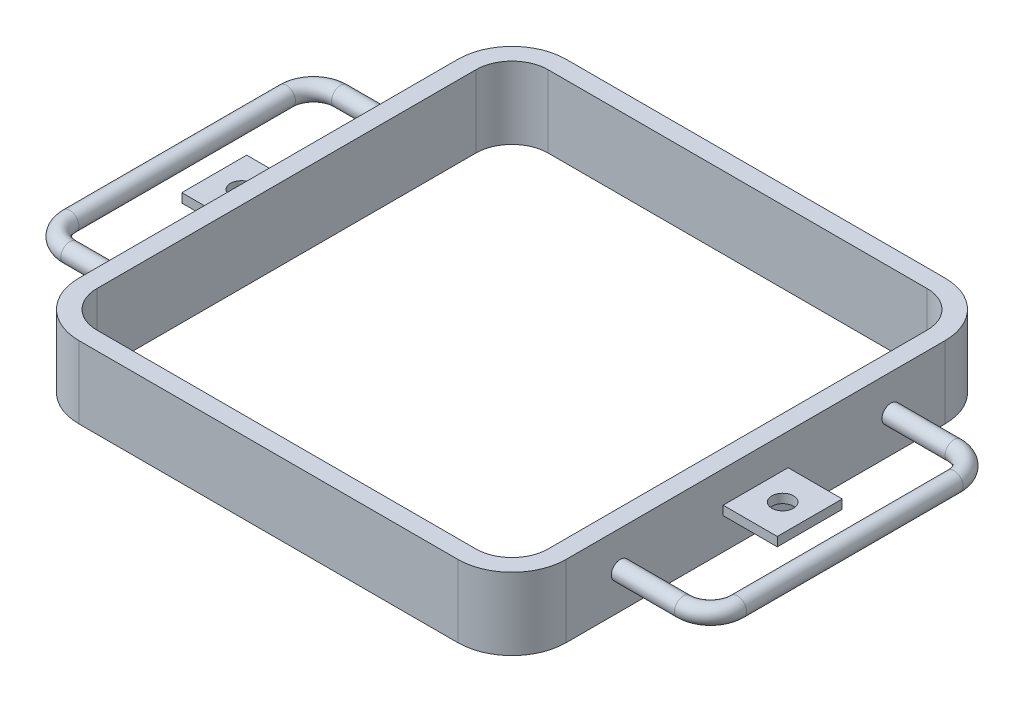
SolidWorks part; units mm, degrees
ref_plane "Front Plane" through (0, 0, 0) normal (0, 0, 1) x (1, 0, 0)
ref_plane "Top Plane" through (0, 0, 0) normal (0, 1, 0) x (1, 0, 0)
ref_plane "Right Plane" through (0, 0, 0) normal (1, 0, 0) x (0, 0, -1)
sketch "Sketch1" plane through (0, 0, 0) normal (0, 1, 0) x (1, 0, 0)
  line L0 (-135, 105) -> (-135, -105)
  line L1 (-105, 125) -> (105, 125)
  line L2 (-125, 105) -> (-125, -105)
  line L3 (-105, -125) -> (105, -125)
  line L4 (125, 105) -> (125, -105)
  line L5 (-125, 125) -> (125, -125) construction
  line L6 (-125, -125) -> (125, 125) construction
  line L7 (-105, -135) -> (105, -135)
  line L8 (135, 105) -> (135, -105)
  line L9 (-105, 135) -> (105, 135)
  arc A0 (105, 125) -> (125, 105) centre (105, 105) cw
  arc A1 (105, -125) -> (125, -105) centre (105, -105) ccw
  arc A2 (-125, -105) -> (-105, -125) centre (-105, -105) ccw
  arc A3 (-105, 125) -> (-125, 105) centre (-105, 105) ccw
  arc A4 (-135, -105) -> (-105, -135) centre (-105, -105) ccw
  arc A5 (105, -135) -> (135, -105) centre (105, -105) ccw
  arc A6 (105, 135) -> (135, 105) centre (105, 105) cw
  arc A7 (-105, 135) -> (-135, 105) centre (-105, 105) ccw
  point P0 (0, 0)
  dimension "D3" = 20
  dimension "D1" = 250
  dimension "D2" = 250
  dimension "D4" = 10
extrude "Boss-Extrude1" add sketch "Sketch1" along normal mid plane 40
sketch "Sketch2" plane through (0, 0, 135) normal (0, 0, 1) x (1, 0, 0)
  line L0 (-105, 15) -> (105, 15) construction
  line L1 (-105, -20) -> (105, -20) construction
  line L2 (-105, 20) -> (-105, -20) construction
  line L4 (105, 20) -> (105, -20) construction
  text T0 "GRAND ASIA" font "Century Gothic" height in points 85
  dimension "D1" = 35
extrude "Boss-Extrude2" [suppressed] add sketch "Sketch2" along normal blind 0.1
sketch "Sketch3" plane through (0, 0, 0) normal (0, 1, 0) x (1, 0, 0)
  line L0 (0, 0) -> (0, 135) construction
  line L1 (105, 135) -> (-105, 135) construction
  line L2 (-135, -75) -> (-170, -75)
  line L4 (-135, 105) -> (-135, -105) construction
  line L5 (-185, -60) -> (-185, 60)
  line L6 (-170, 75) -> (-135, 75)
  line L7 (0, 0) -> (-135, 0) construction
  arc A0 (-185, 60) -> (-170, 75) centre (-170, 60) cw
  arc A1 (-170, -75) -> (-185, -60) centre (-170, -60) cw
  point P14 (-185, 75)
  point P17 (-185, -75)
  dimension "D3" = 15
  dimension "D1" = 50
  dimension "D2" = 150
ref_plane "Plane1" through (-135, 0, 75) normal (-1, 0, 0) x (0, 0, 1)
sketch "Sketch4" plane through (-135, 0, 75) normal (-1, 0, 0) x (0, 0, 1)
  circle A0 centre (0, 0) radius 5
  dimension "D1" = 10
sweep "Sweep1" add profiles "Sketch4" path "Sketch3"
sketch "Sketch5" plane through (0, 0, 0) normal (0, 1, 0) x (1, 0, 0)
  line L0 (0, 0) -> (-125, 0) construction
  line L1 (-125, 105) -> (-125, -105) construction
  line L2 (-135, 105) -> (-135, -105) construction
  line L3 (-135, 18) -> (-165, 18)
  line L4 (-135, 18) -> (-135, -18)
  line L5 (-135, -18) -> (-165, -18)
  line L6 (-165, 18) -> (-165, -18)
  line L7 (-165, 0) -> (-135, 0) construction
  circle A0 centre (-150, 0) radius 6
  dimension "D3" = 12
  dimension "D1" = 30
  dimension "D2" = 36
extrude "Boss-Extrude3" add sketch "Sketch5" along normal mid plane 5
mirror "Mirror1" about plane through (0, 0, 0) normal (1, 0, 0) of "Boss-Extrude3", "Sweep1"
